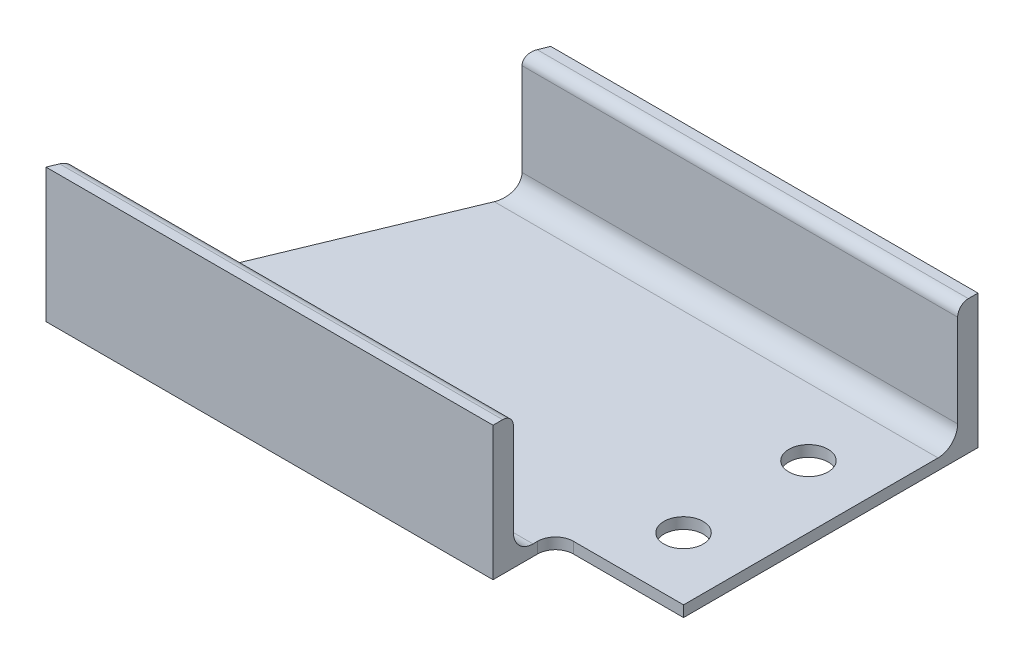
SolidWorks part; units mm, degrees
ref_plane "Front Plane" through (0, 0, 0) normal (0, 0, 1) x (1, 0, 0)
ref_plane "Top Plane" through (0, 0, 0) normal (0, 1, 0) x (1, 0, 0)
ref_plane "Right Plane" through (0, 0, 0) normal (1, 0, 0) x (0, 0, -1)
ref_plane "Member Plane" through (0, 0, 0) normal (0, 1, 0) x (-1, 0, 0)
sketch "Member Sketch" plane through (0, 0, 0) normal (0, 1, 0) x (1, 0, 0)
  line L0 (0, 0) -> (345, 0)
  line L2 (0, 0) -> (345, 0) construction
other "Structural Member1"
ref_plane "Plane1" through (0, 23.4, -100) normal (1, 0, 0) x (0, 1, 0)
sketch "Sketch11" plane through (0, 23.4, -100) normal (1, 0, 0) x (0, 1, 0)
  line L0 (-23.4, 100) -> (-23.4, -100)
  line L1 (0, 0) -> (-23.4, 0) construction
  line L2 (-23.4, 100) -> (51.6, 100)
  line L3 (45.6, 88.6) -> (-6.2, 88.6)
  line L4 (-17.2, 77.6) -> (-17.2, -77.6)
  line L5 (51.6, 100) -> (51.6, 94.6)
  line L6 (51.6, -100) -> (51.6, -94.6)
  line L7 (45.6, -88.6) -> (-6.2, -88.6)
  line L8 (-23.4, -100) -> (51.6, -100)
  line L9 (14.1, 100) -> (14.1, -100) construction
  line L10 (-23.4, 0) -> (51.6, 0) construction
  line L11 (51.6, 88.6) -> (51.6, -88.6) construction
  line L12 (0, 100) -> (0, -100) construction
  line L13 (21.6, 100) -> (21.6, -100) construction
  arc A0 (-17.2, -77.6) -> (-6.2, -88.6) centre (-6.2, -77.6) ccw
  arc A1 (-17.2, 77.6) -> (-6.2, 88.6) centre (-6.2, 77.6) cw
  circle A2 centre (21.6, 100) radius 1.5 construction
  circle A3 centre (21.6, -100) radius 1.5 construction
  circle A4 centre (21.6, 0) radius 1.5 construction
  arc A5 (51.6, -94.6) -> (45.6, -88.6) centre (45.6, -94.6) ccw
  arc A6 (45.6, 88.6) -> (51.6, 94.6) centre (45.6, 94.6) ccw
  point P10 (-17.2, 0)
  point P19 (-17.2, -100)
  point P20 (-23.4, -88.6)
  point P21 (-23.4, 88.6)
  point P22 (-17.2, 100)
  point P31 (14.1, 0)
  point P38 (0, 0)
  dimension "D1" = 3
  dimension "Root Radius(r1)" = 11
  dimension "Toe Radius(r2)" = 6
  dimension "Flange Thickness(T)" = 11.4
  dimension "Section Depth(D)" = 200
  dimension "Flange Width(B)" = 75
  dimension "Web Thickness(t)" = 6.2
  dimension "Centre of Area(Cy)" = 23.4
  dimension "BackGuage" = 45
ref_plane "Plane2" through (0, 0, 0) normal (-0.9239, 0, -0.3827) x (-0.3827, 0, 0.9239)
other "Trim/Extend1"
other "0008-AABE002-CN02-FP03D02-1 - MEMBER2 CAVITY"
other "0008-AABE002<1>@0008-AA/0008-AABE002-CN02-FP03<1>@0008-AABE002/0008-AABE002-CN02-FP03D02<1>@0008-AABE002-CN02-FP031"
other "0008-AABE002-CN02-FP03D01-1 - MEMBER2 CAVITY"
other "0008-AABE002<1>@0008-AA/0008-AABE002-CN02-FP03<1>@0008-AABE002/0008-AABE002-CN02-FP03D01<1>@0008-AABE002-CN02-FP031"
